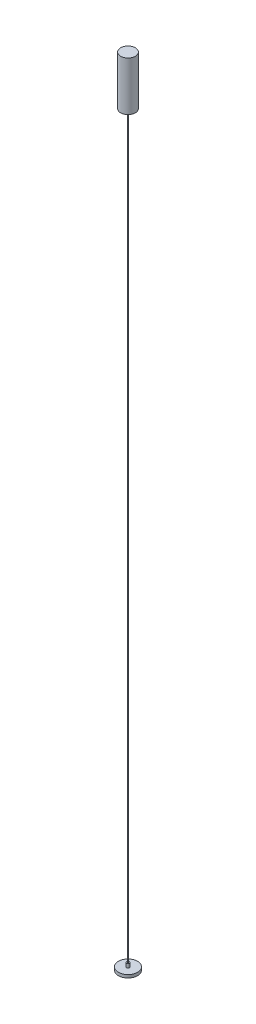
SolidWorks part; units mm, degrees
ref_plane "Alzado" through (0, 0, 0) normal (0, 0, 1) x (1, 0, 0)
ref_plane "Planta" through (0, 0, 0) normal (0, 1, 0) x (1, 0, 0)
ref_plane "Vista lateral" through (0, 0, 0) normal (1, 0, 0) x (0, 0, -1)
sketch "Croquis1" plane through (0, 0, 0) normal (0, 1, 0) x (1, 0, 0)
  circle A0 centre (0, 0) radius 39
  dimension "D1" = 78
extrude "Saliente-Extruir1" add sketch "Croquis1" along normal blind 12
sketch "Croquis2" plane through (0, 12, 0) normal (0, 1, 0) x (1, 0, 0)
  circle A0 centre (0, 0) radius 6
  dimension "D1" = 12
extrude "Saliente-Extruir2" add sketch "Croquis2" along normal blind 15 separate body
sketch "Croquis3" plane through (0, 27, 0) normal (0, 1, 0) x (1, 0, 0)
  circle A0 centre (0, 0) radius 2
extrude "Saliente-Extruir3" add sketch "Croquis3" along normal blind 3000 separate body
sketch "Croquis4" plane through (0, 3027, 0) normal (0, 1, 0) x (1, 0, 0)
  circle A0 centre (-0.2235, 0) radius 6
  dimension "D1" = 12
extrude "Saliente-Extruir4" add sketch "Croquis4" along normal blind 15 separate body
sketch "Croquis5" plane through (0, 3042, 0) normal (0, 1, 0) x (1, 0, 0)
  circle A0 centre (0, 0) radius 30
  dimension "D1" = 60
extrude "Saliente-Extruir5" add sketch "Croquis5" along normal blind 200 separate body
